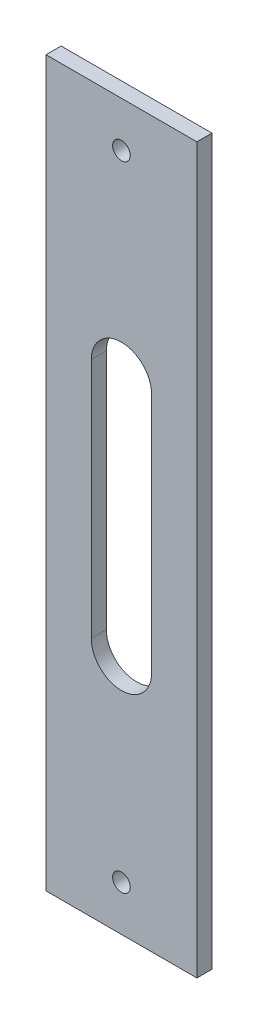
SolidWorks part; units mm, degrees
ref_plane "Front" through (0, 0, 0) normal (0, 0, 1) x (1, 0, 0)
ref_plane "Top" through (0, 0, 0) normal (0, 1, 0) x (1, 0, 0)
ref_plane "Right" through (0, 0, 0) normal (1, 0, 0) x (0, 0, -1)
sketch "Sketch1" plane through (0, 0, 0) normal (0, 0, 1) x (1, 0, 0)
  line L1 (7.9375, -38.1) -> (-7.9375, -38.1)
  line L2 (7.9375, -38.1) -> (7.9375, 38.1)
  line L3 (7.9375, 38.1) -> (-7.9375, 38.1)
  line L4 (-7.9375, -38.1) -> (-7.9375, 38.1)
extrude "Extrude1" add sketch "Sketch1" along normal up to surface (1.5875 mm away)
sketch "Sketch2" plane through (0, 0, 1.5875) normal (0, 0, 1) x (1, 0, 0)
  line L0 (-3.175, -12.7) -> (-3.175, 12.7)
  line L1 (3.175, 12.7) -> (3.175, -12.7)
  line L2 (0, 0) -> (0, 10.7764) construction
  line L3 (0, 0) -> (3.8222, 0) construction
  arc A0 (-3.175, 12.7) -> (3.175, 12.7) centre (0, 12.7) cw
  arc A1 (3.175, -12.7) -> (-3.175, -12.7) centre (0, -12.7) cw
  dimension "D1" = 25.4
  dimension "D2" = 6.35
extrude "Cut-Extrude1" cut sketch "Sketch2" against normal through all
sketch "Sketch3" plane through (0, 0, 1.5875) normal (0, 0, 1) x (1, 0, 0)
  circle A0 centre (0, 33.3375) radius 0.9271 construction
  circle A1 centre (0, 33.3375) radius 0.9271
  circle A2 centre (0, -33.3375) radius 0.9271 construction
  circle A3 centre (0, -33.3375) radius 0.9271
extrude "Cut-Extrude2" cut sketch "Sketch3" against normal through all
